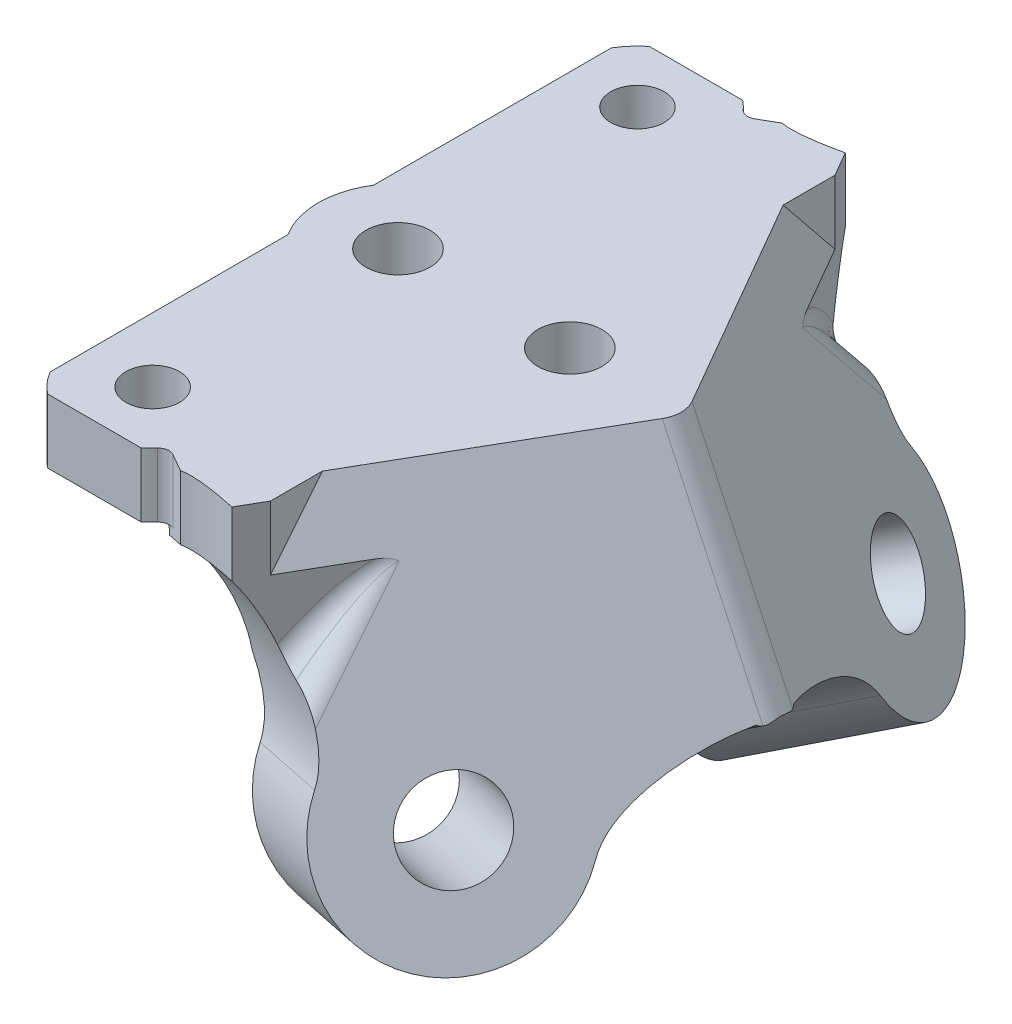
SolidWorks part; units mm, degrees
ref_plane "Front Plane" through (0, 0, 0) normal (0, 0, 1) x (1, 0, 0)
ref_plane "Top Plane" through (0, 0, 0) normal (0, 1, 0) x (1, 0, 0)
ref_plane "Right Plane" through (0, 0, 0) normal (1, 0, 0) x (0, 0, -1)
sketch "Sketch2" plane through (300.6892, 140.2137, 173.603) normal (0.803, 0.3745, 0.4636) x (0.4202, 0.1959, -0.886)
  line L0 (172.4836, 535.6878) -> (180.1308, 546.7646) construction
  line L1 (198.4725, 534.1019) -> (161.789, 559.4272)
  circle A0 centre (172.4836, 535.6878) radius 4
  arc A1 (164.4656, 541.6636) -> (180.9135, 530.3084) centre (172.4836, 535.6878) ccw
  spline S0 degree 3 poles (164.4656, 541.6636) (167.6783, 545.9743) (164.8522, 557.3125) (161.789, 559.4272) knots 0 0 0 0 1 1 1 1
  spline S1 degree 3 poles (180.9135, 530.3084) (183.8055, 534.8404) (195.4094, 536.2167) (198.4725, 534.1019) knots 0 0 0 0 1 1 1 1
  point P8 (180.1308, 546.7646)
  dimension "D1" = 8
extrude "Boss-Extrude1" add sketch "Sketch2" against normal blind 15
mirror "Mirror1" about plane through (0, 0, 0) normal (0, 0, 1) of "Boss-Extrude1"
sketch "Sketch3" plane through (-60.2368, 473.3969, -278.0146) normal (-0.1091, 0.8572, -0.5034) x (0.994, 0.094, -0.0552)
  line L4 (193.6383, -369.8991) -> (218.093, -336.3816)
  line L5 (218.093, -336.3816) -> (200.3539, -335.2454)
  line L6 (200.3539, -335.2454) -> (181.5208, -361.058)
  line L7 (181.5208, -361.058) -> (193.6383, -369.8991)
  line L8 (193.6383, -369.8991) -> (218.093, -336.3816)
  line L9 (218.093, -336.3816) -> (200.3539, -335.2454)
  line L10 (200.3539, -335.2454) -> (181.5208, -361.058)
  line L11 (181.5208, -361.058) -> (193.6383, -369.8991)
  dimension "D1" = 0
extrude "Boss-Extrude2" add sketch "Sketch3" along normal blind 25
sketch "Sketch4" plane through (-60.2368, 473.3969, 278.0146) normal (-0.1091, 0.8572, 0.5034) x (0.994, 0.094, 0.0552)
  line L4 (200.3539, 335.2454) -> (218.093, 336.3816)
  line L5 (218.093, 336.3816) -> (193.6383, 369.8991)
  line L6 (193.6383, 369.8991) -> (181.5208, 361.058)
  line L7 (181.5208, 361.058) -> (200.3539, 335.2454)
  line L8 (200.3539, 335.2454) -> (218.093, 336.3816)
  line L9 (218.093, 336.3816) -> (193.6383, 369.8991)
  line L10 (193.6383, 369.8991) -> (181.5208, 361.058)
  line L11 (181.5208, 361.058) -> (200.3539, 335.2454)
  dimension "D1" = 0
sketch "Sketch5" plane through (288.6439, 134.5969, 166.6487) normal (-0.803, -0.3745, -0.4636) x (-0.4202, -0.1959, 0.886)
  circle A0 centre (-172.4836, 535.6878) radius 4
  circle A1 centre (-172.4836, 535.6878) radius 3
extrude "Boss-Extrude4" add sketch "Sketch5" against normal blind 2
mirror "Mirror2" about plane through (0, 0, 0) normal (0, 0, 1) of "Boss-Extrude4", "Boss-Extrude2"
sketch "Sketch6" plane through (300.6892, 140.2137, 173.603) normal (0.803, 0.3745, 0.4636) x (0.4202, 0.1959, -0.886)
  line L1 (244.9667, 512.1667) -> (148.366, 512.1667)
  line L2 (244.9667, 512.1667) -> (244.9667, 580.7729)
  line L3 (244.9667, 580.7729) -> (148.366, 580.7729)
  line L4 (148.366, 512.1667) -> (148.366, 580.7729)
  line L5 (244.9667, 512.1667) -> (148.366, 580.7729) construction
  line L6 (244.9667, 580.7729) -> (148.366, 512.1667) construction
  point P0 (196.6663, 546.4698)
extrude "Cut-Extrude1" cut sketch "Sketch6" along normal through all
sketch "Sketch7" plane through (300.6892, 140.2137, -173.603) normal (0.803, 0.3745, -0.4636) x (-0.4202, -0.1959, -0.886)
  line L1 (-294.5771, 643.8728) -> (-151.9551, 643.8728)
  line L2 (-294.5771, 643.8728) -> (-294.5771, 526.0743)
  line L3 (-294.5771, 526.0743) -> (-151.9551, 526.0743)
  line L4 (-151.9551, 643.8728) -> (-151.9551, 526.0743)
  line L5 (-294.5771, 643.8728) -> (-151.9551, 526.0743) construction
  line L6 (-294.5771, 526.0743) -> (-151.9551, 643.8728) construction
  point P0 (-223.2661, 584.9735)
extrude "Cut-Extrude2" cut sketch "Sketch7" along normal through all
fillet "Fillet1" radius 0.5 2 edges at (153.2748, 660.7895, -5.1879) (153.2748, 660.7895, 5.1879)
ref_plane "Plane1" through (143.7164, 0, 0) normal (1, 0, 0) x (0, 0, -1)
sketch "Sketch8" plane through (143.7164, 0, 0) normal (1, 0, 0) x (0, 0, -1)
  line L0 (-34.4256, 683.2232) -> (36.1066, 683.2232)
  line L1 (-34.4256, 683.2232) -> (-34.4256, 703.0837)
  line L2 (-34.4256, 703.0837) -> (36.1066, 703.0837)
  line L3 (36.1066, 703.0837) -> (36.1066, 683.2232)
extrude "Cut-Extrude3" cut sketch "Sketch8" against normal through all both and the other way through all
sketch "Sketch9" plane through (0, 683.2232, 0) normal (0, 1, 0) x (1, 0, 0)
  line L0 (135.2706, 20.4317) -> (147.7095, 0)
  line L1 (131.6997, 27.7297) -> (147.7095, 0) construction
  line L3 (129.0299, 0) -> (147.7095, 0) construction
  line L6 (118.9397, 17.4767) -> (129.0299, 0) construction
  line L7 (129.0299, 0) -> (118.9397, -17.4767) construction
  line L8 (135.2706, -20.4317) -> (147.7095, 0)
  line L9 (118.9397, -17.4767) -> (118.9397, 16.6675) construction
  line L10 (118.9397, -17.4767) -> (120.2011, -23.2983) construction
  line L11 (131.6997, -27.7297) -> (118.9397, -17.4767) construction
  line L12 (135.2706, 20.4317) -> (135.2706, 37.9985)
  line L13 (135.2706, 37.9985) -> (114.5075, 37.9985)
  line L14 (114.5075, 37.9985) -> (114.5075, -37.9985)
  line L15 (135.2706, -37.9985) -> (114.5075, -37.9985)
  line L16 (135.2706, -20.4317) -> (135.2706, -37.9985)
  point P23 (114.5075, 0)
extrude "Boss-Extrude5" add sketch "Sketch9" against normal blind 6
sketch "Sketch11" plane through (-108.2061, 65.3165, -134.6643) normal (-0.5859, 0.3537, -0.7291) x (-0.8104, -0.2557, 0.5272)
  line L3 (-281.2336, 600.1663) -> (-292.2025, 597.0492)
  line L4 (-292.2025, 597.0492) -> (-281.848, 595.6428)
  line L5 (-281.848, 595.6428) -> (-281.2336, 600.1663)
  line L7 (-292.2025, 597.0492) -> (-281.848, 595.6428)
  line L8 (-281.848, 595.6428) -> (-281.2336, 600.1663)
  line L9 (-281.2336, 600.1663) -> (-292.2025, 597.0492)
  dimension "D1" = 0
extrude "Boss-Extrude6" [suppressed] add sketch "Sketch11" along normal blind 15
sketch "Sketch13" [suppressed] plane through (0, 677.2232, 0) normal (0, -1, 0) x (1, 0, 0)
  line L0 (135.2706, -28.8851) -> (110.6055, -28.8851)
  line L1 (135.2706, -26.3907) -> (135.2706, -37.9985) construction
  line L2 (110.6055, -28.8851) -> (110.6055, -39.4073)
  line L3 (110.6055, -39.4073) -> (136.112, -39.4073)
  line L4 (136.112, -39.4073) -> (136.112, -28.8851)
  line L5 (136.112, -28.8851) -> (135.2706, -28.8851)
extrude "Cut-Extrude4" [suppressed] cut sketch "Sketch13" along normal through all both
sketch "Sketch16" plane through (0, 677.2232, 0) normal (0, -1, 0) x (1, 0, 0)
  line L0 (135.2706, -26.3907) -> (133.9476, -28.6823)
  line L1 (135.2706, -26.3907) -> (135.2706, -37.9985) construction
  line L2 (133.9476, -28.6823) -> (135.2706, -26.3907) construction
  line L3 (133.9476, -28.6823) -> (128.0752, -38.8536)
  line L4 (128.0752, -38.8536) -> (137.4386, -38.8536)
  line L5 (137.4386, -38.8536) -> (135.2706, -26.3907)
  line L6 (131.8278, 0) -> (113.6252, 0) construction
  line L7 (119.7032, -21.0004) -> (131.8278, 0) construction
  line L8 (141.8385, 0) -> (131.8278, 0) construction
  line L9 (137.4386, 38.8536) -> (135.2706, 26.3907)
  line L10 (135.2706, 26.3907) -> (133.9476, 28.6823)
  line L11 (133.9476, 28.6823) -> (128.0752, 38.8536)
  line L12 (128.0752, 38.8536) -> (137.4386, 38.8536)
  spline S0 degree 3 poles (128.5923, -28.143) (128.8193, -28.0938) (129.045, -28.0735) (129.4951, -28.0546) (129.7195, -28.0574) (130.3918, -28.0864) (130.8386, -28.1331) (132.1769, -28.3131) (133.0657, -28.4865) (133.9476, -28.6823) knots 0 0 0 0 0.125 0.125 0.25 0.25 0.5 0.5 1 1 1 1 construction
fillet "Fillet2" [suppressed] radius 12
chamfer "Chamfer1" distance 7 1 edges at (136.8331, 666.4892, 0)
sketch "Sketch19" plane through (-108.2061, 65.3165, 134.6643) normal (-0.5859, 0.3537, 0.7291) x (0.8104, 0.2557, 0.5272)
  line L3 (281.848, 595.6428) -> (292.2025, 597.0492)
  line L4 (292.2025, 597.0492) -> (281.2336, 600.1663)
  line L5 (281.2336, 600.1663) -> (281.848, 595.6428)
  line L6 (281.848, 595.6428) -> (292.2025, 597.0492)
  line L7 (292.2025, 597.0492) -> (281.2336, 600.1663)
  line L8 (281.2336, 600.1663) -> (281.848, 595.6428)
  dimension "D1" = 0
extrude "Boss-Extrude7" add sketch "Sketch19" along normal blind 10
sketch "Sketch21" plane through (-108.2061, 65.3165, -134.6643) normal (-0.5859, 0.3537, -0.7291) x (-0.8104, -0.2557, 0.5272)
  line L3 (-281.2336, 600.1663) -> (-292.2025, 597.0492)
  line L4 (-292.2025, 597.0492) -> (-281.848, 595.6428)
  line L5 (-281.848, 595.6428) -> (-281.2336, 600.1663)
  line L6 (-281.2336, 600.1663) -> (-292.2025, 597.0492)
  line L7 (-292.2025, 597.0492) -> (-281.848, 595.6428)
  line L8 (-281.848, 595.6428) -> (-281.2336, 600.1663)
  dimension "D1" = 0
extrude "Boss-Extrude8" add sketch "Sketch21" along normal blind 10
sketch "Sketch20" plane through (0, 677.2232, 0) normal (0, -1, 0) x (1, 0, 0)
  line L0 (128.5923, 28.143) -> (120.2011, 23.2983)
  line L1 (120.2011, 23.2983) -> (128.5923, 28.143) construction
  line L2 (120.2011, 23.2983) -> (113.1766, 19.2427)
  line L3 (113.1766, 19.2427) -> (110.5862, 41.5244)
  line L4 (110.5862, 41.5244) -> (135.2706, 37.9985)
  line L5 (114.5075, 0) -> (150, 0) construction
  line L6 (114.5075, 30.5402) -> (115.1491, 31.0557)
  line L7 (115.1491, 31.0557) -> (128.5923, 28.143)
  line L8 (133.9476, 28.6823) -> (135.2706, 26.3907)
  line L9 (135.2706, 26.3907) -> (135.2706, 37.9985)
  line L10 (135.2706, 37.9985) -> (114.5075, 37.9985)
  line L11 (114.5075, 37.9985) -> (114.5075, 30.5402)
  line L14 (133.9476, 28.6823) -> (135.2706, 26.3907)
  line L15 (135.2706, 26.3907) -> (135.2706, 37.9985)
  line L18 (114.5075, -37.9985) -> (114.5075, -30.5402) construction
  line L19 (139.0767, 0) -> (152.5742, 0) construction
  line L20 (135.2706, -26.3907) -> (135.2706, -37.9985)
  line L21 (133.9476, -28.6823) -> (135.2706, -26.3907)
  line L22 (110.5862, -41.5244) -> (135.2706, -37.9985)
  line L23 (113.1766, -19.2427) -> (110.5862, -41.5244)
  line L24 (120.2011, -23.2983) -> (113.1766, -19.2427)
  line L25 (128.5923, -28.143) -> (120.2011, -23.2983)
  spline S0 degree 3 poles (120.2011, 23.2983) (122.3819, 20.5842) (128.3611, 18.0802) (128.833, 20.9268) knots 0 0 0 0 1 1 1 1 construction
  spline S1 degree 3 poles (-58.9326, 3022.0665) (103.2704, 60.7335) (117.0718, 28.5767) (129.4951, 28.0546) (129.7195, 28.0574) (130.3918, 28.0864) (130.8386, 28.1331) (173.7525, 33.9034) (208.4345, 160.8044) (-143.354, -2957.4719) knots -6.650025 -6.650025 -6.650025 -6.650025 0.125 0.125 0.25 0.25 0.5 0.5 24.298454 24.298454 24.298454 24.298454 only from (128.5923, 28.143) to (133.9476, 28.6823)
  spline S2 degree 3 poles (128.5923, 28.143) (128.8193, 28.0938) (129.045, 28.0735) (129.4951, 28.0546) (129.7195, 28.0574) (130.3918, 28.0864) (130.8386, 28.1331) (132.1769, 28.3131) (133.0657, 28.4865) (133.9476, 28.6823) knots 0 0 0 0 0.125 0.125 0.25 0.25 0.5 0.5 1 1 1 1
  spline S3 degree 3 poles (128.5923, -28.143) (128.8193, -28.0938) (129.045, -28.0735) (129.4951, -28.0546) (129.7195, -28.0574) (130.3918, -28.0864) (130.8386, -28.1331) (132.1769, -28.3131) (133.0657, -28.4865) (133.9476, -28.6823) knots 0 0 0 0 0.125 0.125 0.25 0.25 0.5 0.5 1 1 1 1
  dimension "D1" = 0
extrude "Cut-Extrude6" cut sketch "Sketch20" against normal through all both and the other way through all
fillet "Fillet3" radius 2.5 2 edges at (135.2706, 676.3249, -27.1163) (135.2706, 676.3249, 27.1163)
fillet "Fillet4" radius 2 2 edges at (137.8802, 674.7568, 21.8708) (137.8802, 674.7568, -21.8708)
sketch "Sketch22" plane through (0, 677.2232, 0) normal (0, -1, 0) x (1, 0, 0)
  line L0 (114.5075, 0) -> (128.2469, 0) construction
  line L1 (114.5075, -20.0111) -> (114.5075, 20.0111) construction
  line L2 (128.2469, -6.2022) -> (128.2469, 6.2022) construction
  line L3 (118.8326, 22.5082) -> (114.5075, 20.0111) construction
  line L4 (114.5075, 20.0111) -> (118.8326, 22.5082) construction
  line L5 (114.5075, 20.0111) -> (110.843, 17.8954)
  line L6 (110.843, 17.8954) -> (110.843, -17.8954)
  line L7 (114.5075, -20.0111) -> (110.843, -17.8954)
  line L8 (118.8326, -22.5082) -> (114.5075, -20.0111) construction
  line L9 (114.5075, 20.0111) -> (114.5075, -20.0111)
  point P13 (110.843, 0)
extrude "Boss-Extrude9" [suppressed] add sketch "Sketch22" against normal up to surface (6 mm away)
sketch "Sketch23" [suppressed] plane through (0, 683.2232, 0) normal (0, 1, 0) x (1, 0, 0)
  line L0 (147.7095, 0) -> (110.843, 0) construction
  line L1 (147.7095, 0) -> (135.2706, -21.5447) construction
  line L2 (139.0767, 0) -> (152.5742, 0) construction
  line L3 (110.843, 17.8954) -> (110.843, -17.8954) construction
  circle A0 centre (138.0778, 0) radius 3
extrude "Cut-Extrude7" [suppressed] cut sketch "Sketch23" against normal blind 15
sketch "Sketch24" plane through (0, 677.2232, 0) normal (0, -1, 0) x (1, 0, 0)
  line L0 (125.0414, 11.7543) -> (125.0414, 32.6853)
  line L1 (128.2469, 6.2022) -> (118.8326, 22.5082) construction
  line L2 (125.0414, 32.6853) -> (112.2717, 32.6853)
  line L3 (112.2717, 32.6853) -> (112.2717, -32.6853)
  line L4 (112.2717, 0) -> (151.0018, 0) construction
  line L5 (125.0414, -11.7543) -> (125.0414, -32.6853)
  line L6 (125.0414, -32.6853) -> (112.2717, -32.6853)
  line L7 (125.0414, 11.7543) -> (125.0414, -11.7543)
extrude "Cut-Extrude8" cut sketch "Sketch24" along normal blind 15
fillet "Fillet5" [suppressed] radius 4
sketch "Sketch25" plane through (0, 677.2232, 0) normal (0, -1, 0) x (1, 0, 0)
  line L0 (114.5075, 20.0111) -> (114.5075, 28.143)
  line L1 (128.5923, 28.143) -> (114.5075, 28.143)
  line L2 (125.0414, 26.0929) -> (128.5923, 28.143) construction
  line L3 (114.5075, 20.0111) -> (128.5923, 28.143)
  line L4 (114.5075, 0) -> (139.0767, 0) construction
  line L5 (114.5075, -20.0111) -> (114.5075, 20.0111) construction
  line L6 (139.0767, 0) -> (152.5742, 0) construction
  line L7 (114.5075, -20.0111) -> (114.5075, -28.143)
  line L8 (128.5923, -28.143) -> (114.5075, -28.143)
  line L9 (114.5075, -20.0111) -> (128.5923, -28.143)
extrude "Boss-Extrude10" add sketch "Sketch25" against normal up to surface (6 mm away)
sketch "Sketch26" plane through (0, 677.2232, 0) normal (0, -1, 0) x (1, 0, 0)
  line L0 (114.5075, 0) -> (128.2469, 0) construction
  line L1 (114.5075, -28.143) -> (114.5075, 28.143) construction
  line L2 (128.2469, -6.2022) -> (128.2469, 6.2022) construction
  circle A0 centre (120.5258, 22.6684) radius 3 construction
  circle A1 centre (120.5258, 22.6684) radius 7
  circle A2 centre (120.5258, -22.6684) radius 7
extrude "Cut-Extrude9" cut sketch "Sketch26" along normal blind 15
sketch "Sketch27" plane through (0, 677.2232, 0) normal (0, -1, 0) x (1, 0, 0)
  line L0 (128.5923, 28.143) -> (126.203, 26.7635)
  line L1 (126.203, 26.7635) -> (128.5923, 28.143) construction
  line L2 (116.1635, 28.143) -> (114.5075, 28.143)
  line L3 (114.5075, 28.143) -> (114.5075, 26.2435)
  line L4 (114.5075, -28.143) -> (114.5075, 28.143) construction
  line L5 (128.5923, 28.143) -> (124.888, 28.143)
  line L6 (114.5075, 0) -> (128.5923, 0) construction
  line L7 (128.5923, -28.143) -> (124.888, -28.143)
  line L8 (114.5075, -28.143) -> (114.5075, -26.2435)
  line L9 (116.1635, -28.143) -> (114.5075, -28.143)
  line L10 (128.5923, -28.143) -> (126.203, -26.7635)
  arc A1 (126.203, -26.7635) -> (124.888, -28.143) centre (120.5258, -22.6684) cw
  arc A2 (116.1635, 28.143) -> (114.5075, 26.2435) centre (120.5258, 22.6684) ccw
  arc A3 (126.203, 26.7635) -> (124.888, 28.143) centre (120.5258, 22.6684) ccw
  arc A4 (116.1635, -28.143) -> (114.5075, -26.2435) centre (120.5258, -22.6684) cw
  spline S0 degree 3 poles (128.5923, 28.143) (128.8193, 28.0938) (129.045, 28.0735) (129.4951, 28.0546) (129.7195, 28.0574) (130.3918, 28.0864) (130.8386, 28.1331) (132.1769, 28.3131) (133.0657, 28.4865) (133.9476, 28.6823) knots 0 0 0 0 0.125 0.125 0.25 0.25 0.5 0.5 1 1 1 1 construction
extrude "Cut-Extrude10" cut sketch "Sketch27" against normal blind 15
sketch "Sketch28" plane through (0, 677.2232, 0) normal (0, -1, 0) x (1, 0, 0)
  line L0 (114.5075, 4.0099) -> (114.5075, -4.0099)
  line L1 (114.5075, -26.2435) -> (114.5075, 26.2435) construction
  arc A0 (114.5075, 4.0099) -> (114.5075, -4.0099) centre (120.8456, 0) ccw
extrude "Boss-Extrude11" add sketch "Sketch28" against normal up to surface (6 mm away)
mirror "Mirror3" [suppressed] about plane through (0, 0, 0) normal (0, 0, 1)
sketch "Sketch29" plane through (0, 677.2232, 0) normal (0, -1, 0) x (1, 0, 0)
  arc A0 (126.8531, 19.6742) -> (126.203, 26.7635) centre (120.5258, 22.6684) ccw construction
  arc A1 (126.8531, 19.6742) -> (126.203, 26.7635) centre (120.5258, 22.6684) ccw
sketch "Sketch31" plane through (0, 677.2232, 0) normal (0, -1, 0) x (1, 0, 0)
  line L0 (113.3456, 0) -> (128.2469, 0) construction
  line L1 (128.2469, -6.2022) -> (128.2469, 6.2022) construction
  arc A0 (114.5075, 4.0099) -> (114.5075, -4.0099) centre (120.8456, 0) ccw construction
  circle A1 centre (120.7962, 0) radius 3
  arc A2 (126.8531, 19.6742) -> (126.203, 26.7635) centre (120.5258, 22.6684) ccw construction
  arc A3 (126.8531, 19.6742) -> (126.203, 26.7635) centre (120.5258, 22.6684) ccw construction
  circle A4 centre (120.5258, 22.6684) radius 2.5
  circle A5 centre (120.5258, -22.6684) radius 2.5
extrude "Cut-Extrude11" cut sketch "Sketch31" against normal blind 15
sketch "Sketch32" plane through (0, 683.2232, 0) normal (0, 1, 0) x (1, 0, 0)
  circle A0 centre (136.8702, 0) radius 3
extrude "Cut-Extrude12" cut sketch "Sketch32" against normal blind 12
fillet "Fillet6" radius 2 5 edges at (125.0414, 677.2232, 14.537) (126.6442, 677.2232, 8.9783) (128.2469, 677.2232, 0) (126.6442, 677.2232, -8.9783) (125.0414, 677.2232, -14.537)
fillet "Fillet7" radius 1 2 edges at (127.2352, 677.2232, -20.6725) (127.2352, 677.2232, 20.6725)
fillet "Fillet8" radius 1 2 edges at (126.203, 680.2232, -26.7635) (126.203, 680.2232, 26.7635)
fillet "Fillet9" radius 3 1 edges at (152.3278, 673.3191, 0)
sketch "Sketch33" plane through (300.6892, 140.2137, 173.603) normal (0.803, 0.3745, 0.4636) x (0.4202, 0.1959, -0.886)
  circle A0 centre (172.4836, 535.6878) radius 4.1
extrude "Cut-Extrude13" cut sketch "Sketch33" against normal up to surface (13 mm away) contours A0
sketch "Sketch34" plane through (300.6892, 140.2137, -173.603) normal (0.803, 0.3745, -0.4636) x (-0.4202, -0.1959, -0.886)
  circle A0 centre (-172.4758, 535.6932) radius 4.1
extrude "Cut-Extrude14" cut sketch "Sketch34" against normal up to surface (13 mm away)
sketch "Sketch35" plane through (290.25, 135.3458, 167.5759) normal (0.803, 0.3745, 0.4636) x (0.4202, 0.1959, -0.886)
  circle A1 centre (172.4836, 535.6878) radius 4.1
  circle A2 centre (172.4836, 535.6878) radius 4.1
  dimension "D1" = 0
extrude "Cut-Extrude15" cut sketch "Sketch35" against normal blind 10
sketch "Sketch36" plane through (290.25, 135.3458, -167.5759) normal (0.803, 0.3745, -0.4636) x (-0.4202, -0.1959, -0.886)
  circle A1 centre (-172.4758, 535.6932) radius 4.1
  circle A2 centre (-172.4758, 535.6932) radius 4.1
  dimension "D1" = 0
extrude "Cut-Extrude16" cut sketch "Sketch36" against normal blind 10
